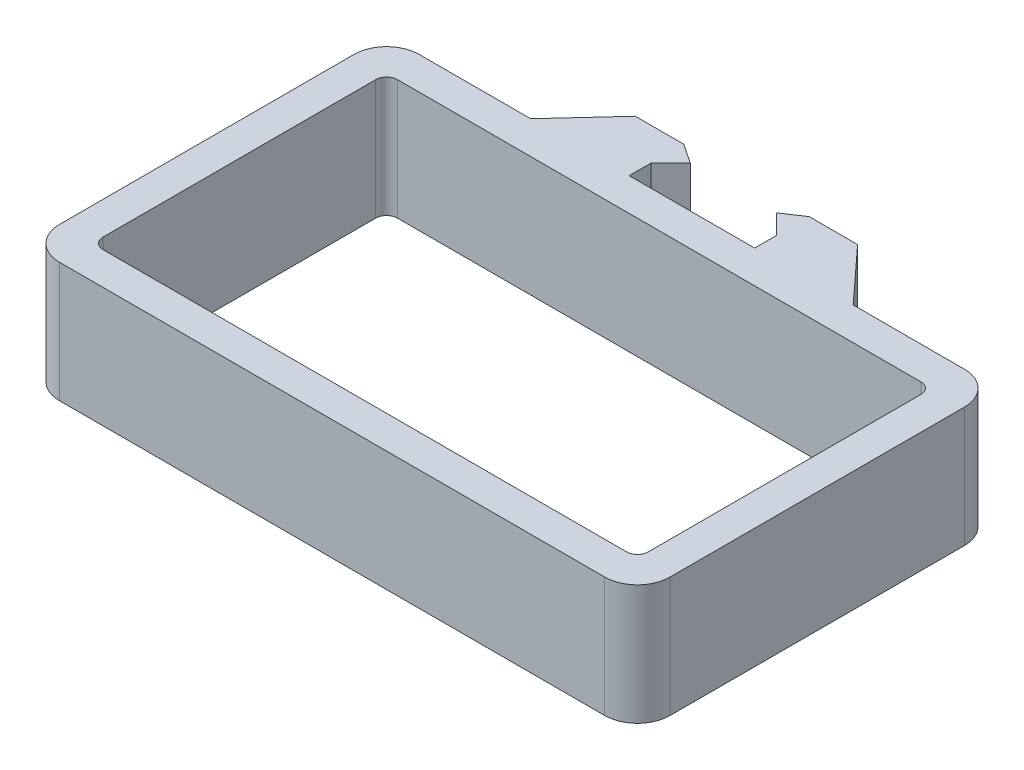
SolidWorks part; units mm, degrees
ref_plane "Front Plane" through (0, 0, 0) normal (0, 0, 1) x (1, 0, 0)
ref_plane "Top Plane" through (0, 0, 0) normal (0, 1, 0) x (1, 0, 0)
ref_plane "Right Plane" through (0, 0, 0) normal (1, 0, 0) x (0, 0, -1)
sketch "Sketch1" plane through (0, 0, 0) normal (0, 1, 0) x (1, 0, 0)
  line L0 (-25, 16.5) -> (25, 16.5)
  line L1 (-24, -13.5) -> (24, -13.5)
  line L2 (-25, -12.5) -> (-25, 12.5)
  line L3 (-24, 13.5) -> (24, 13.5)
  line L4 (25, -12.5) -> (25, 12.5)
  line L5 (-25, -13.5) -> (25, 13.5) construction
  line L6 (-25, 13.5) -> (25, -13.5) construction
  line L7 (28, -13.5) -> (28, 13.5)
  line L8 (-25, -16.5) -> (25, -16.5)
  line L9 (-28, -13.5) -> (-28, 13.5)
  line L10 (-25, -13.5) -> (25, -13.5) construction
  line L11 (25, -13.5) -> (25, 13.5) construction
  line L12 (-25, -13.5) -> (-25, 13.5) construction
  line L13 (-25, 13.5) -> (25, 13.5) construction
  line L14 (28, -16.5) -> (28, 16.5) construction
  line L15 (-28, -16.5) -> (28, -16.5) construction
  line L16 (-28, -16.5) -> (-28, 16.5) construction
  line L17 (-28, 16.5) -> (28, 16.5) construction
  line L26 (5.75, 16.5) -> (5.75, 18.5)
  line L27 (5.75, 18.5) -> (3.95, 20.3)
  line L28 (3.95, 20.3) -> (5.75, 21.5)
  line L29 (5.75, 21.5) -> (10.1911, 21.5)
  line L30 (10.1911, 21.5) -> (14.7925, 16.5)
  line L31 (0, 16.5) -> (0, 24.8027) construction
  line L32 (5.75, 21.5) -> (5.75, 18.5) construction
  line L33 (-5.75, 21.5) -> (-5.75, 18.5) construction
  line L34 (-10.1911, 21.5) -> (-14.7925, 16.5)
  line L35 (-5.75, 21.5) -> (-10.1911, 21.5)
  line L36 (-3.95, 20.3) -> (-5.75, 21.5)
  line L37 (-5.75, 18.5) -> (-3.95, 20.3)
  line L38 (-5.75, 16.5) -> (-5.75, 18.5)
  arc A0 (24, -13.5) -> (25, -12.5) centre (24, -12.5) ccw
  arc A1 (-24, -13.5) -> (-25, -12.5) centre (-24, -12.5) cw
  arc A2 (-25, 12.5) -> (-24, 13.5) centre (-24, 12.5) cw
  arc A3 (24, 13.5) -> (25, 12.5) centre (24, 12.5) cw
  arc A4 (28, -13.5) -> (25, -16.5) centre (25, -13.5) cw
  arc A5 (-25, -16.5) -> (-28, -13.5) centre (-25, -13.5) cw
  arc A6 (-25, 16.5) -> (-28, 13.5) centre (-25, 13.5) ccw
  arc A7 (25, 16.5) -> (28, 13.5) centre (25, 13.5) cw
  point P0 (0, 0)
  dimension "D4" = 1
  dimension "D5" = 3
  dimension "D1" = 27
  dimension "D2" = 50
  dimension "D6" = 7.9
  dimension "D7" = 2
  dimension "D8" = 45
  dimension "D9" = 1.8
  dimension "D10" = 3
  dimension "D11" = 11.5
  dimension "D3" = 3
extrude "Boss-Extrude1" add sketch "Sketch1" along normal blind 11 contours A7 L0 A6 L9 A5 L8 A4 L7 L3 A3 L4 A0 L1 A1 L2 A2 | L0 L38 L37 L36 L35 L34 | L30 L29 L28 L27 L26 L0
